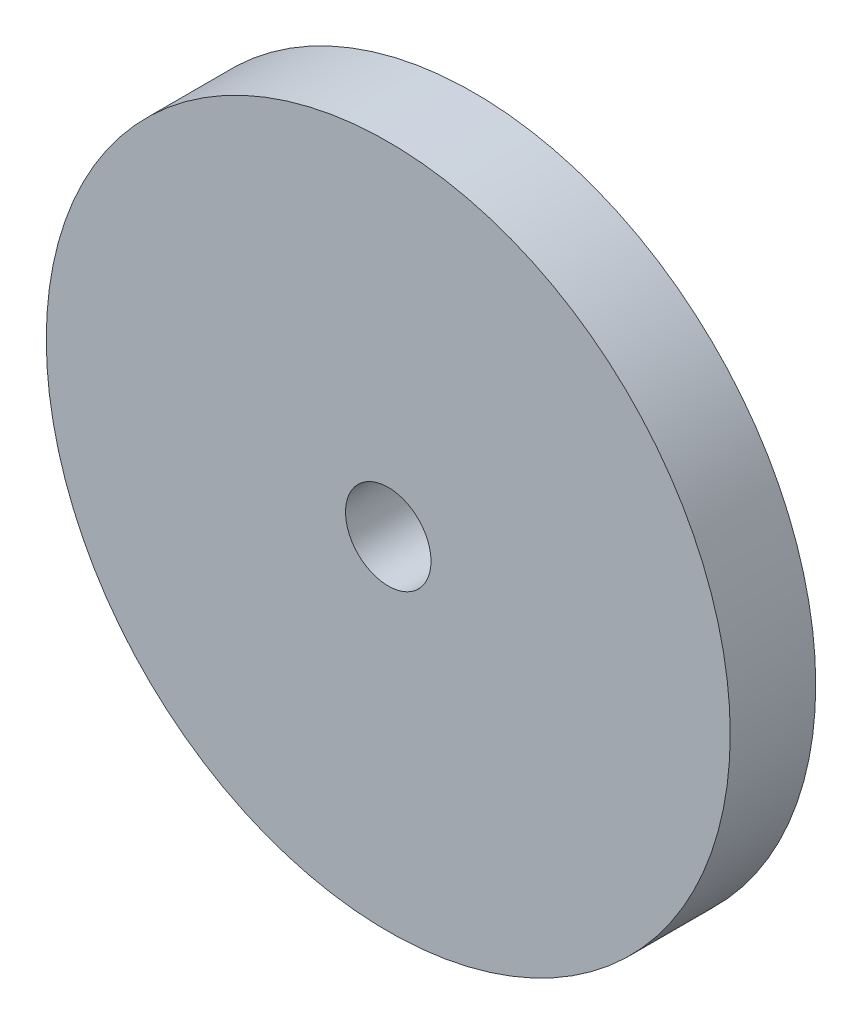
SolidWorks part; units mm, degrees
ref_plane "Front Plane" through (0, 0, 0) normal (0, 0, 1) x (1, 0, 0)
ref_plane "Top Plane" through (0, 0, 0) normal (0, 1, 0) x (1, 0, 0)
ref_plane "Right Plane" through (0, 0, 0) normal (1, 0, 0) x (0, 0, -1)
sketch "Sketch1" plane through (0, 0, 0) normal (0, 0, 1) x (1, 0, 0)
  circle A0 centre (0, 0) radius 12.7
  circle A1 centre (0, 0) radius 1.5875
  dimension "D1" = 3.175
  dimension "D2" = 25.4
extrude "Boss-Extrude1" add sketch "Sketch1" along normal blind 3.175
